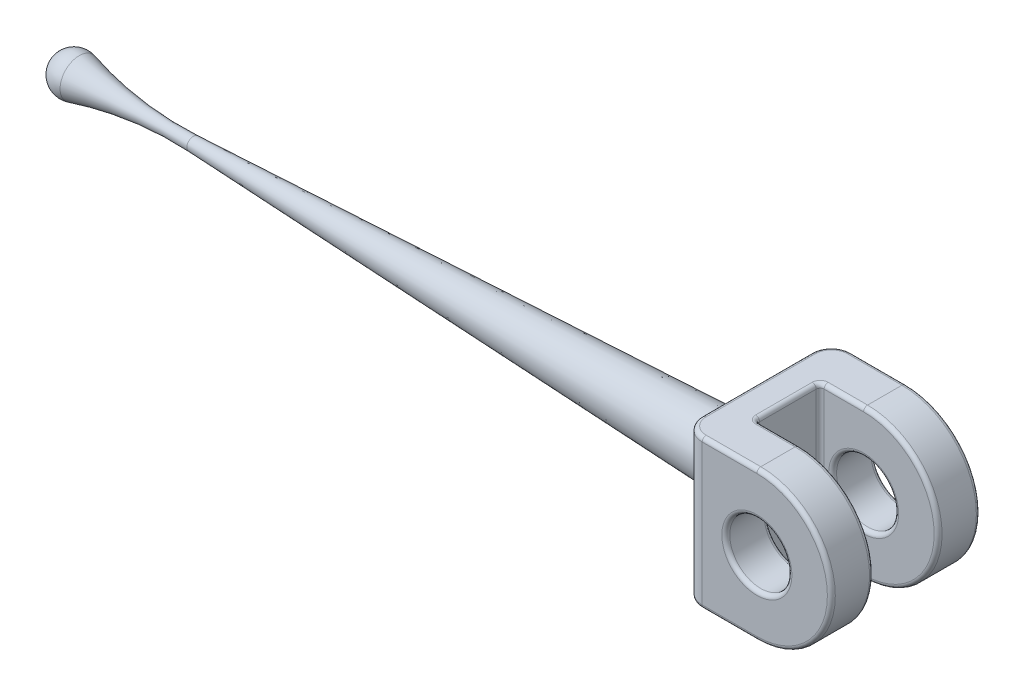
SolidWorks part; units mm, degrees
ref_plane "Front Plane" through (0, 0, 0) normal (0, 0, 1) x (1, 0, 0)
ref_plane "Top Plane" through (0, 0, 0) normal (0, 1, 0) x (1, 0, 0)
ref_plane "Right Plane" through (0, 0, 0) normal (1, 0, 0) x (0, 0, -1)
sketch "Sketch2" plane through (0, 0, 0) normal (0, 0, 1) x (1, 0, 0)
  line L1 (0, -7.62) -> (-7.62, -7.62)
  line L2 (7.62, -7.62) -> (7.62, 7.62) construction
  line L3 (0, 7.62) -> (-7.62, 7.62)
  line L4 (-7.62, -7.62) -> (-7.62, 7.62)
  line L5 (7.62, -7.62) -> (-7.62, 7.62) construction
  line L6 (7.62, 7.62) -> (-7.62, -7.62) construction
  circle A0 centre (0, 0) radius 3.175
  arc A1 (0, 7.62) -> (0, -7.62) centre (0, 0) cw
  point P0 (0, 0)
  dimension "D1" = 6.35
  dimension "D2" = 15.24
  dimension "D3" = 15.24
extrude "Boss-Extrude1" add sketch "Sketch2" along normal mid plane 15.24
sketch "Sketch3" plane through (0, 0, 0) normal (0, 0, 1) x (1, 0, 0)
  line L0 (0, 0) -> (-157.5623, 0) construction
  line L1 (-7.62, 3.175) -> (-65.2636, 0.6582)
  line L2 (-7.62, 7.62) -> (-7.62, -7.62) construction
  line L4 (-79.502, 0) -> (-7.62, 0)
  line L5 (-7.62, 0) -> (-7.62, 3.175)
  arc A0 (-79.502, 0) -> (-76.9361, 1.9606) centre (-77.47, 0) cw
  arc A1 (-65.2636, 0.6582) -> (-76.9361, 1.9606) centre (-66.9255, 38.722) cw
  dimension "D2" = 2.032
  dimension "D5" = 38.1
  dimension "D1" = 6.35
  dimension "D3" = 69.85
  dimension "D4" = 71.882
  dimension "D7" = 2.5
revolve "Revolve1" add sketch "Sketch3" angle 360 about L0
sketch "Sketch4" plane through (0, 0, 0) normal (0, 1, 0) x (1, 0, 0)
  line L3 (-4.445, 3.302) -> (12.3825, 3.302)
  line L4 (12.3825, -3.302) -> (-4.445, -3.302)
  line L5 (-4.445, 3.302) -> (-4.445, -3.302)
  line L16 (0, 0) -> (14.9225, 0) construction
  line L18 (-7.62, -7.62) -> (-7.62, 7.62) construction
  line L19 (14.9225, 5.842) -> (14.9225, -5.842)
  arc A2 (14.9225, 5.842) -> (12.3825, 3.302) centre (12.3825, 5.842) cw
  arc A3 (14.9225, -5.842) -> (12.3825, -3.302) centre (12.3825, -5.842) ccw
  dimension "D1" = 2.54
  dimension "D2" = 3.175
  dimension "D3" = 6.604
  dimension "D4" = 19.3675
extrude "Cut-Extrude1" cut sketch "Sketch4" against normal through all and the other way through all
fillet "Fillet1" radius 2.032 3 edges at (-7.62, 3.175, 0) (-7.62, 0, -7.62) (-7.62, 0, 7.62)
fillet "Fillet2" radius 0.4064 26 edges at (-4.445, -7.62, 0) (-4.445, 7.62, 0) (-2.2225, -7.62, -3.302) (-2.794, -7.62, -7.62) (-7.0248, -7.62, -7.0248) (-7.62, -7.62, 0) (-7.0248, -7.62, 7.0248) (-2.2225, -7.62, 3.302) (-2.2225, 7.62, -3.302) (-2.794, 7.62, -7.62) (-7.0248, 7.62, -7.0248) (-7.62, 7.62, 0) (-7.0248, 7.62, 7.0248) (-2.794, 7.62, 7.62) (-2.794, -7.62, 7.62) (-2.2225, 7.62, 3.302) (3.175, 0, 3.302) (3.175, 0, 7.62) (-3.175, 0, -3.302) (3.175, 0, -7.62) (-4.445, 0, 3.302) (-4.445, 0, -3.302) (7.62, 0, -3.302) (7.62, 0, -7.62) (7.62, 0, 7.62) (7.62, 0, 3.302)
